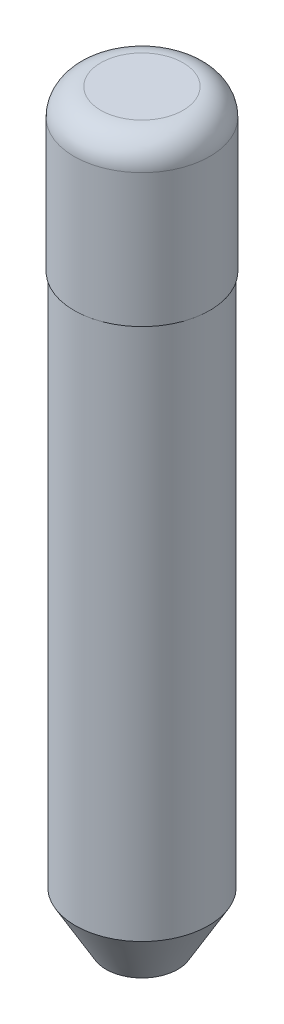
SolidWorks part; units mm, degrees
ref_plane "Front Plane" through (0, 0, 0) normal (0, 0, 1) x (1, 0, 0)
ref_plane "Top Plane" through (0, 0, 0) normal (0, 1, 0) x (1, 0, 0)
ref_plane "Right Plane" through (0, 0, 0) normal (1, 0, 0) x (0, 0, -1)
sketch "Sketch1" plane through (0, 0, 0) normal (0, 0, 1) x (1, 0, 0)
  line L0 (0, 39.0068) -> (0, -41.829) construction
  line L1 (0, -1.777) -> (0, 1.777) construction
  line L2 (0, 8.89) -> (-1.6154, 8.89)
  line L3 (-1.6154, 8.89) -> (-1.6154, 5.08)
  line L4 (-1.6154, 5.08) -> (-1.5875, 5.08)
  line L5 (-1.5875, 5.08) -> (-1.5875, -7.62)
  line L6 (-1.5875, -7.62) -> (-0.8543, -8.89)
  line L7 (-0.8543, -8.89) -> (0, -8.89)
  line L8 (0, -8.89) -> (0, 8.89)
  line L9 (1.777, 0) -> (-1.777, 0) construction
  dimension "D1" = 3.175
  dimension "D2" = 8.89
  dimension "D3" = 17.78
  dimension "D4" = 3.81
  dimension "D5" = 3.2309
  dimension "D6" = 1.27
  dimension "D7" = 30
revolve "Revolve1" add sketch "Sketch1" angle 360 about L0
fillet "Fillet1" radius 0.635 1 edges at (0, 8.89, 1.6154)
